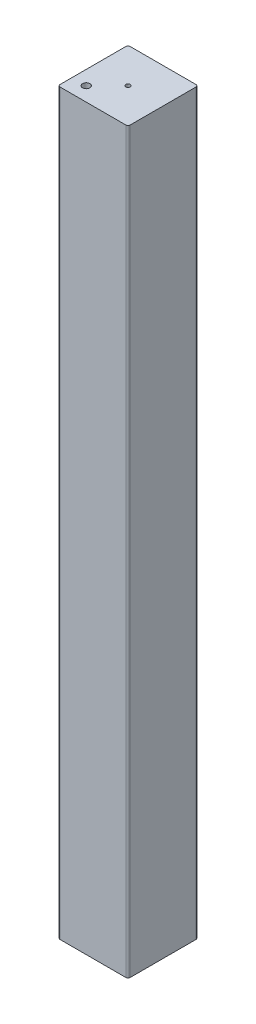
SolidWorks part; units mm, degrees
ref_plane "Front Plane" through (0, 0, 0) normal (0, 0, 1) x (1, 0, 0)
ref_plane "Top Plane" through (0, 0, 0) normal (0, 1, 0) x (1, 0, 0)
ref_plane "Right Plane" through (0, 0, 0) normal (1, 0, 0) x (0, 0, -1)
sketch "Sketch1" plane through (0, 0, 0) normal (0, 1, 0) x (1, 0, 0)
  line L0 (-47.5, -47.5) -> (47.5, 47.5) construction
  line L1 (47.5, 47.5) -> (-47.5, 47.5)
  line L2 (47.5, 47.5) -> (47.5, -47.5)
  line L3 (47.5, -47.5) -> (-47.5, -47.5)
  line L4 (-47.5, 47.5) -> (-47.5, -47.5)
  dimension "D1" = 95
extrude "Extrude längd" add sketch "Sketch1" along normal blind 1000
sketch "Sketch hålplacering" plane through (0, 1000, 0) normal (0, 1, 0) x (-1, 0, 0)
  line L0 (47.5, 47.5) -> (-47.5, -47.5) construction
  circle A0 centre (0, 0) radius 3
  circle A1 centre (28.2843, 28.2843) radius 5
  point P4 (0, 0)
  dimension "D1" = 10
  dimension "D2" = 6
  dimension "D3" = 40
sketch "Sketch3" plane through (0, 1000, -1000) normal (0, -1, 0) x (1, 0, 0)
  circle A1 centre (0, 1000) radius 3 construction
  circle A2 centre (0, 1000) radius 3
extrude "Cut-skruvhål" cut sketch "Sketch3" along normal blind 25
sketch "Sketch2" plane through (0, 1000, -1000) normal (0, -1, 0) x (1, 0, 0)
  circle A1 centre (-28.2843, 1028.2843) radius 5 construction
  circle A2 centre (-28.2843, 1028.2843) radius 5
extrude "Cut-tapphål" cut sketch "Sketch2" along normal blind 15
fillet "Fillet1" radius 3 4 edges at (47.5, 500, 47.5) (-47.5, 500, 47.5) (-47.5, 500, -47.5) (47.5, 500, -47.5)
